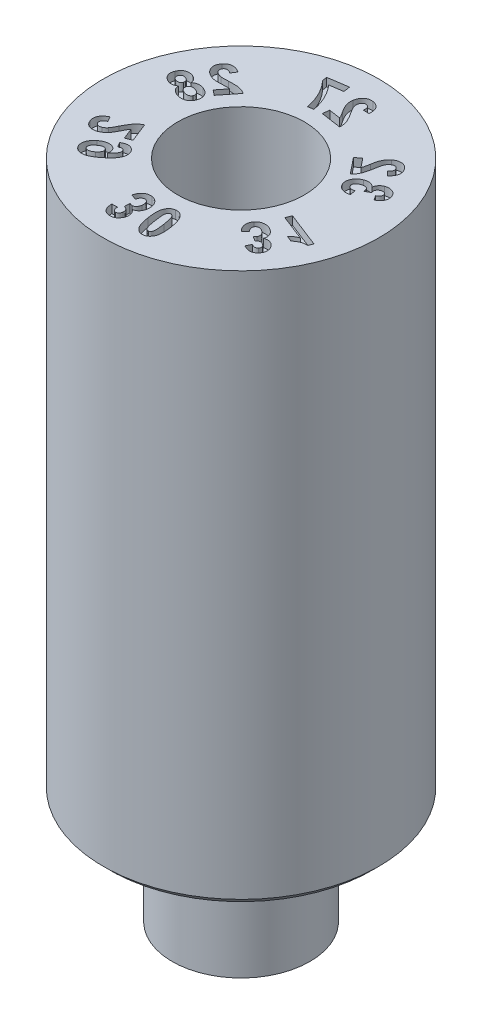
SolidWorks part; units mm, degrees
other "<M5L10-SetScrew>-<Chamfer1>" parameters "D10"=0.24
ref_plane "Front Plane" through (0, 0, 0) normal (0, 0, 1) x (1, 0, 0)
ref_plane "Top Plane" through (0, 0, 0) normal (0, 1, 0) x (1, 0, 0)
ref_plane "Right Plane" through (0, 0, 0) normal (1, 0, 0) x (0, 0, -1)
sketch "Sketch1" plane through (0, 0, 0) normal (0, 0, 1) x (1, 0, 0)
  line L0 (0, 0) -> (0, 20) construction
  line L1 (0, -5.5) -> (0, 5.5) construction
  line L2 (2.5, -20) -> (4.76, -20)
  line L4 (5, -19.76) -> (5, 0)
  line L5 (5, 0) -> (2.3, 0)
  line L6 (2.3, 0) -> (2.3, -4)
  line L7 (2.3, -4) -> (1.25, -4)
  line L8 (1.25, -4) -> (1.25, -14)
  line L9 (1.25, -14) -> (2.5, -14)
  line L10 (2.5, -14) -> (2.5, -20)
  line L11 (4.76, -20) -> (5, -19.76)
  point P6 (5, -20)
  dimension "D1" = 4
  dimension "D2" = 6
  dimension "D3" = 2.5
  dimension "D4" = 4.6
  dimension "D5" = 10
  dimension "D6" = 5
  dimension "D7" = 20
revolve "Revolve1" add sketch "Sketch1" angle 360 about L0
sketch "Sketch2" plane through (0, 0, 0) normal (0, 1, 0) x (1, 0, 0)
  line L0 (0, 0) -> (0, 4.1718) construction
  line L1 (0, 0) -> (3.6129, 2.0859) construction
  line L2 (0, 0) -> (3.6129, -2.0859) construction
  line L3 (0, 0) -> (0, -4.1718) construction
  line L4 (0, 0) -> (-3.6129, -2.0859) construction
  line L5 (0, 0) -> (-3.6129, 2.0859) construction
  arc A0 (0.8401, 2.7711) -> (1.8359, 2.2393) centre (0, 0) ccw construction
  text T0 "27   28   29   30   31   32" font "Arial Narrow" height 1.35
  point P13 (0, 0)
  point P17 (0, 0)
  point P18 (0, 0)
  point P20 (0, 0)
  dimension "D1" = 2.8957
  dimension "D2" = 6
extrude "Cut-Extrude1" cut sketch "Sketch2" against normal blind 0.3
inserted part "M5L10-SetScrew"
move or copy body "Body-Move/Copy2" placed by mates yes
other "Distance1" parameters "D1"=4
